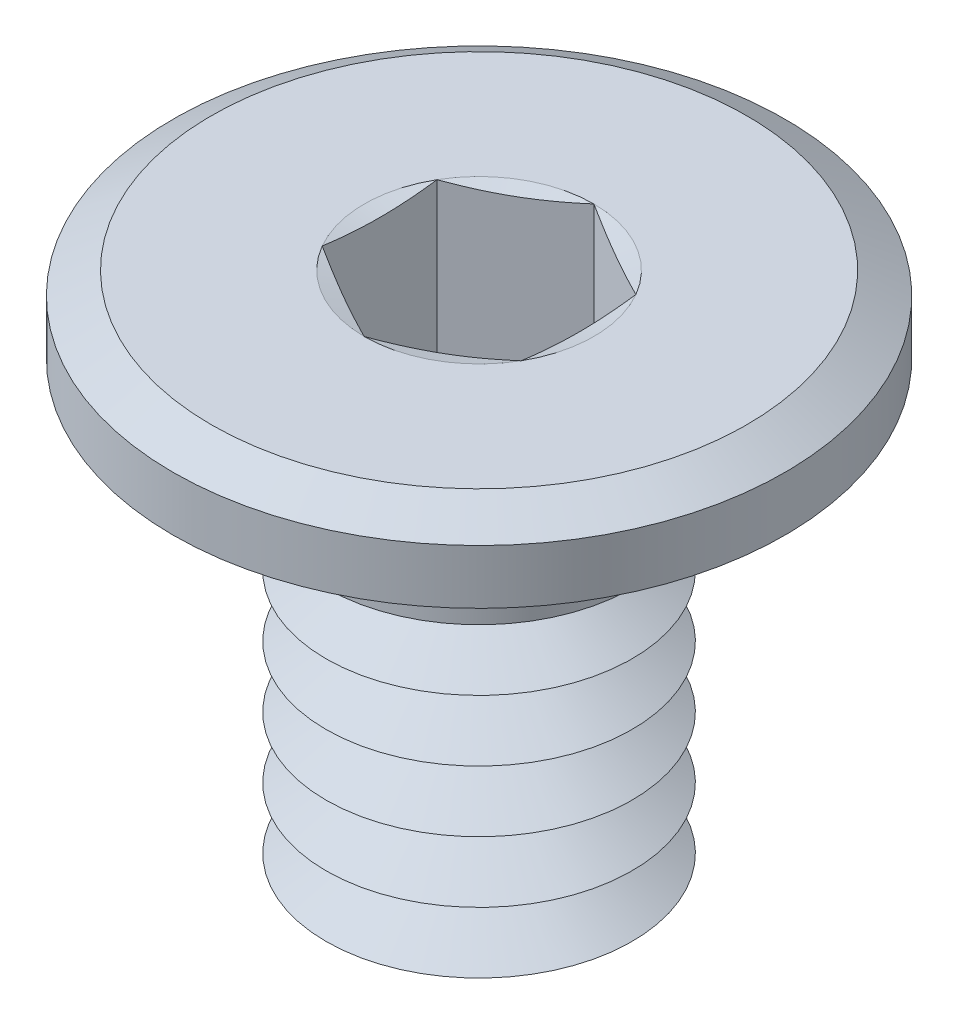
SolidWorks part; units mm, degrees
ref_plane "Front Plane" through (0, 0, 0) normal (0, 0, 1) x (1, 0, 0)
ref_plane "Top Plane" through (0, 0, 0) normal (0, 1, 0) x (1, 0, 0)
ref_plane "Right Plane" through (0, 0, 0) normal (1, 0, 0) x (0, 0, -1)
sketch "Sketch1" plane through (0, 0, 0) normal (0, 1, 0) x (1, 0, 0)
  circle A0 centre (0, 0) radius 2
  dimension "D1" = 4
extrude "Boss-Extrude1" add sketch "Sketch1" against normal blind 0.5
sketch "Sketch2" plane through (0, -0.5, 0) normal (0, -1, 0) x (1, 0, 0)
  circle A0 centre (0, 0) radius 1
  dimension "D1" = 2
extrude "Boss-Extrude2" add sketch "Sketch2" along normal blind 3
sketch "Sketch3" plane through (0, 0, 0) normal (1, 0, 0) x (0, 0, -1)
  line L0 (0, 0.9906) -> (0, -8.2999) construction
sketch "Sketch5" plane through (0, 0, 0) normal (1, 0, 0) x (0, 0, -1)
  line L0 (-1, -3.7) -> (-0.6536, -3.5)
  line L1 (-1, -0.5) -> (-1, -3.5) construction
  line L2 (-0.6536, -3.5) -> (-1, -3.3)
  line L3 (-1, -0.5) -> (-1, -3.5) construction
  line L4 (-1, -3.3) -> (-1, -3.7)
  line L6 (-1, -0.5) -> (-1, -3.5) construction
  line L7 (-1, -0.5) -> (-1, -3.5) construction
  line L14 (-1, -3.5) -> (1, -3.5) construction
  dimension "D1" = 0.4
revolve "Cut-Revolve1" cut sketch "Sketch5" angle 360 about L0
pattern_linear "LPattern1" count 6 spacing 0.4 along (0, 1, 0) of "Cut-Revolve1"
fillet "Fillet1" radius 0.1 1 edges at (0, -0.5, -1)
chamfer "Chamfer2" distance 0.25 angle 30 1 edges at (0, 0, 2)
sketch "Sketch6" plane through (0, 0, 0) normal (0, 1, 0) x (1, 0, 0)
  line L1 (0, 0.7506) -> (-0.65, 0.3753)
  line L2 (-0.65, 0.3753) -> (-0.65, -0.3753)
  line L3 (-0.65, -0.3753) -> (0, -0.7506)
  line L4 (0, -0.7506) -> (0.65, -0.3753)
  line L5 (0.65, -0.3753) -> (0.65, 0.3753)
  line L6 (0.65, 0.3753) -> (0, 0.7506)
  circle A0 centre (0, 0) radius 0.65 construction
  dimension "D1" = 1.3
extrude "Cut-Extrude1" cut sketch "Sketch6" against normal blind 1.2
sketch "Sketch7" plane through (0, -1.2, 0) normal (0, 1, 0) x (1, 0, 0)
  line L0 (-0.65, 0.3753) -> (-0.65, -0.3753) construction
  circle A0 centre (0, 0) radius 0.65
extrude "Cut-Extrude2" cut sketch "Sketch7" against normal through all draft 60
sketch "Sketch8" plane through (0, 0, 0) normal (0, 1, 0) x (1, 0, 0)
  circle A0 centre (0, 0) radius 0.7506
extrude "Cut-Extrude3" cut sketch "Sketch8" against normal through all draft 75
